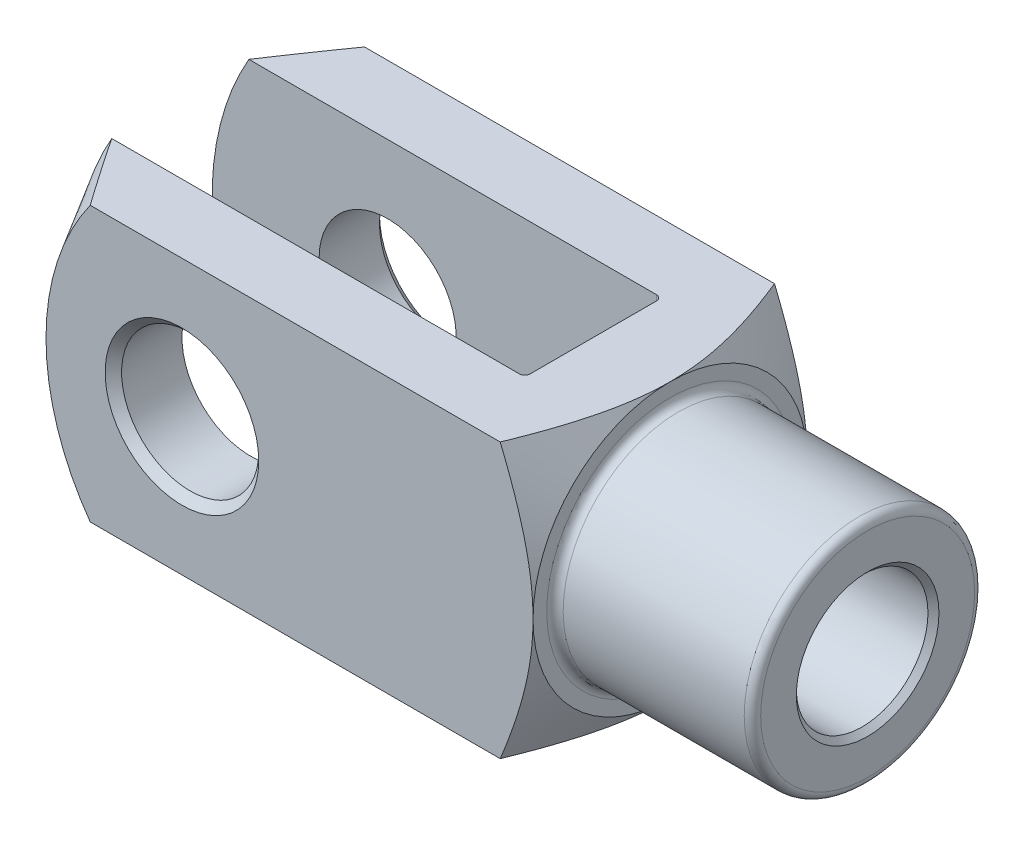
SolidWorks part; units mm, degrees
ref_plane "Front Plane" through (0, 0, 0) normal (0, 0, 1) x (1, 0, 0)
ref_plane "Top Plane" through (0, 0, 0) normal (0, 1, 0) x (1, 0, 0)
ref_plane "Right Plane" through (0, 0, 0) normal (1, 0, 0) x (0, 0, -1)
sketch "Sketch1" plane through (0, 0, 0) normal (1, 0, 0) x (0, 0, -1)
  line L0 (0, 0) -> (0, 50000) construction
  line L1 (0, 0) -> (50000, 0) construction
  line L2 (-25, -25) -> (-25, 25)
  line L3 (-25, 25) -> (25, 25)
  line L4 (25, -25) -> (25, 25)
  line L5 (-25, -25) -> (25, -25)
  point P9 (0, 25)
  point P11 (25, 0)
  point P12 (-25, 0)
  dimension "D1" = 50
  dimension "D2" = 50
extrude "Extrude1" add sketch "Sketch1" against normal blind 132
sketch "Sketch2" plane through (0, 0, 0) normal (1, 0, 0) x (0, 0, -1)
  circle A0 centre (0, 0) radius 21
  circle A1 centre (0, 0) radius 42
  dimension "D1" = 42
  dimension "D2" = 84
extrude "Extrude2" cut sketch "Sketch2" against normal blind 36
sketch "Sketch3" plane through (0, 0, 25) normal (0, 0, 1) x (1, 0, 0)
  circle A0 centre (-100, 0) radius 12.5
  dimension "D1" = 25
  dimension "D2" = 100
extrude "Extrude3" cut sketch "Sketch3" against normal through all
sketch "Sketch4" plane through (0, 25, 0) normal (0, 1, 0) x (1, 0, 0)
  line L0 (0, 0) -> (-50000, 0) construction
  line L1 (-132, -12.5) -> (-132, 12.5)
  line L2 (-132, 25) -> (-132, -25) construction
  line L3 (-132, 12.5) -> (-50, 12.5)
  line L4 (-50, 12.5) -> (-50, -12.5)
  line L5 (-100, 25) -> (-100, -25) construction
  line L6 (-132, -12.5) -> (-50, -12.5)
  point P7 (-100, 0)
  point P13 (-50, 0)
  point P14 (-132, 0)
  dimension "D1" = 50
  dimension "D2" = 25
extrude "Extrude4" cut sketch "Sketch4" against normal through all
fillet "Fillet1" radius 1 2 edges at (-50, 0, 12.5) (-50, 0, -12.5)
fillet "Fillet2" radius 1.5 2 edges at (0, 0, -21) (-36, 0, -21)
chamfer "Chamfer2" distance 1.5 angle 45 2 edges at (-87.5, 0, -25) (-87.5, 0, 25)
sketch "Sketch6" plane through (0, 0, 0) normal (0, 0, 1) x (1, 0, 0)
  line L0 (-36, -25) -> (-36, -50)
  line L1 (-36, -50) -> (-50.4338, -50)
  line L2 (-50.4338, -50) -> (-36, -25)
  dimension "D1" = 30
  dimension "D2" = 50
revolve "Cut-Revolve1" cut sketch "Sketch6" angle 360 about axis through (-36, 0, 0) along (1, 0, 0)
sketch "Sketch7" plane through (0, 0, 0) normal (0, 1, 0) x (1, 0, 0)
  line L0 (-124.7831, -25) -> (-132, -12.5)
  line L1 (-132, 12.5) -> (-124.7831, 25)
  line L2 (-124.7831, 25) -> (-182, 25)
  line L3 (-132, 12.5) -> (-132, -12.5)
  line L4 (-182, 25) -> (-182, -25)
  line L5 (-182, -25) -> (-124.7831, -25)
  line L6 (-132, 25) -> (-41.9787, 25) construction
  line L7 (-132, -25) -> (-41.9787, -25) construction
  line L8 (-82, 0.6162) -> (-82, 50000.6162) construction
  dimension "D1" = 120
  dimension "D2" = 50
  dimension "D3" = 50
revolve "Cut-Revolve2" cut sketch "Sketch7" angle 180 about L8
sketch "Sketch8" plane through (0, 0, 0) normal (1, 0, 0) x (0, 0, -1)
  circle A0 centre (0, 0) radius 12
  dimension "D1" = 24
extrude "Extrude5" cut sketch "Sketch8" against normal through all
chamfer "Chamfer3" distance 1 angle 45 1 edges at (0, 0, -12)
equation "\"D2@Sketch1\" = \"D1@Sketch1\""
equation "\"D2@Sketch2\" = \"D1@Sketch2\"*2"
equation "\"D2@Sketch6\" = \"D1@Sketch1\""
equation "\"D2@Sketch7\" = \"D1@Sketch1\""
equation "\"D3@Sketch7\" = \"D1@Sketch1\""
